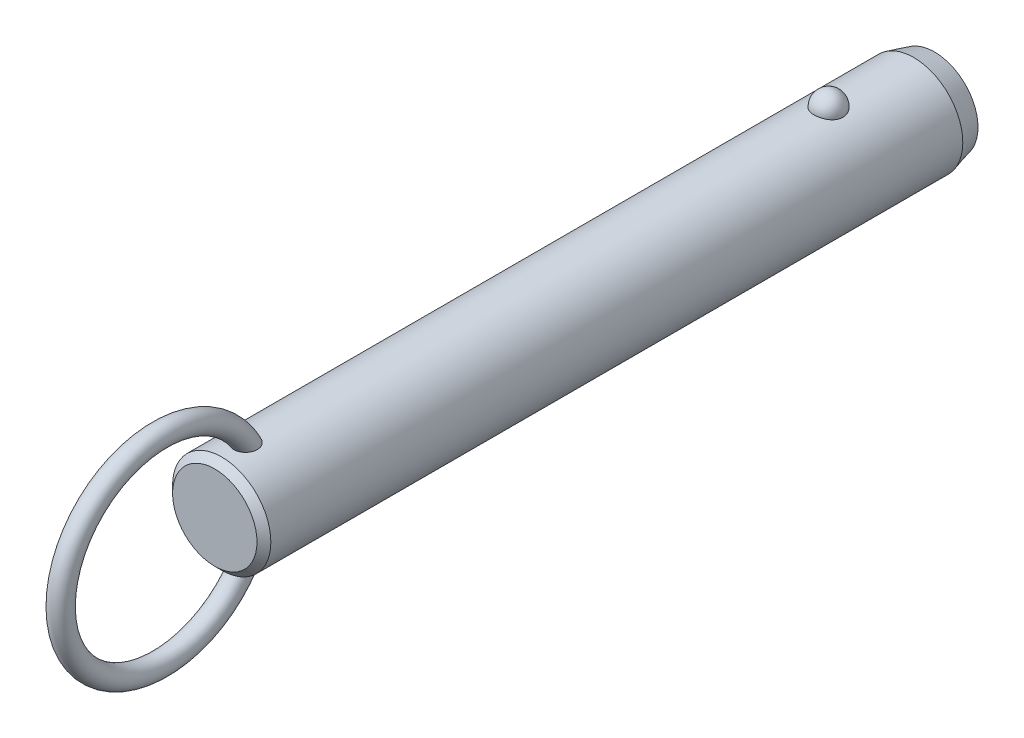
SolidWorks part; units mm, degrees
ref_plane "Front Plane" through (0, 0, 0) normal (0, 0, 1) x (1, 0, 0)
ref_plane "Top Plane" through (0, 0, 0) normal (0, 1, 0) x (1, 0, 0)
ref_plane "Right Plane" through (0, 0, 0) normal (1, 0, 0) x (0, 0, -1)
sketch "Sketch2" plane through (0, 0, 0) normal (0, 0, 1) x (1, 0, 0)
  circle A0 centre (0, 0) radius 7.1
  point P3 (0, 7.1)
  dimension "D1" = 14.2
extrude "Boss-Extrude1" add sketch "Sketch2" along normal blind 78.7
sketch "Sketch3" plane through (0, 0, 0) normal (0, 0, -1) x (-1, 0, 0)
  circle A0 centre (0, 0) radius 7.1
  dimension "D1" = 14.2
extrude "Boss-Extrude2" add sketch "Sketch3" along normal blind 17.4
chamfer "Chamfer1" distance 3 angle 15 1 edges at (-7.1, 0, -17.4)
sketch "Sketch12" plane through (0, 0, 0) normal (1, 0, 0) x (0, 0, -1)
  line L0 (-78.7, 7.1) -> (-78.7, -7.1) construction
  point P0 (-78.7, 0)
sketch "Sketch13" plane through (0, 0, 0) normal (1, 0, 0) x (0, 0, -1)
  circle A0 centre (-94.55, 0) radius 15.85
  point P2 (-78.7, 0)
  dimension "D1" = 31.7
sketch "Sketch14" plane through (0, 0, 0) normal (0, 1, 0) x (1, 0, 0)
  circle A0 centre (0, -80.2) radius 1.5
  point P2 (0, -78.7)
  dimension "D1" = 3
sweep "Sweep1" add profiles "Sketch14" path "Sketch13"
sketch "Sketch15" plane through (0, 0, 78.7) normal (0, 0, 1) x (1, 0, 0)
  circle A0 centre (0, 0) radius 7.1
  dimension "D1" = 14.2
extrude "Boss-Extrude3" add sketch "Sketch15" along normal blind 7.92
chamfer "Chamfer2" distance 1 angle 45 1 edges at (7.1, 0, 86.62)
sketch "Sketch18" plane through (0, 0, 0) normal (1, 0, 0) x (0, 0, -1)
  line L0 (14.4, 7.1) -> (-80.3792, 7.1) construction
  line L1 (2.1, 9.2) -> (2.1, 5)
  line L2 (-80.3792, -7.1) -> (14.4, -7.1) construction
  arc A0 (2.1, 9.2) -> (2.1, 5) centre (2.1, 7.1) ccw
  point P4 (0, 7.1)
  dimension "D1" = 16.3
revolve "Revolve1" add sketch "Sketch18" angle 360 about L1
